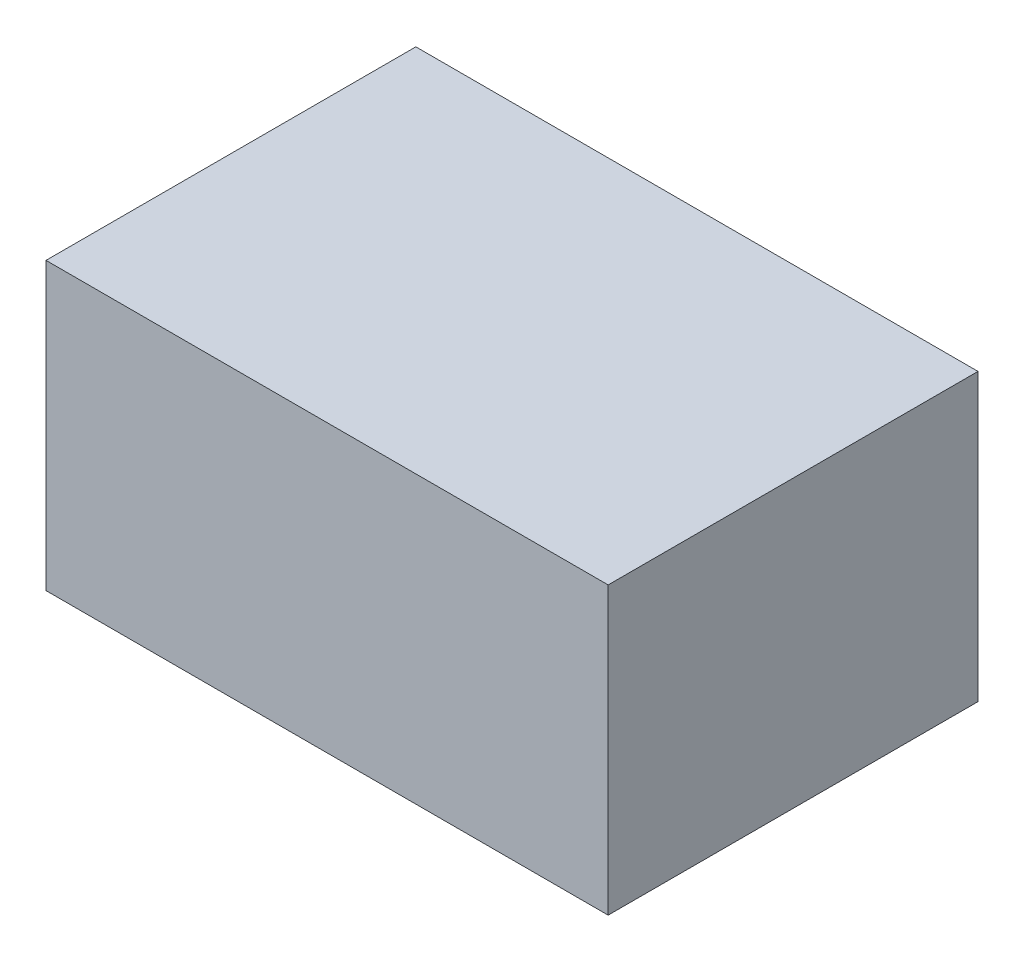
SolidWorks part; units mm, degrees
ref_plane "Front Plane" through (0, 0, 0) normal (0, 0, 1) x (1, 0, 0)
ref_plane "Top Plane" through (0, 0, 0) normal (0, 1, 0) x (1, 0, 0)
ref_plane "Right Plane" through (0, 0, 0) normal (1, 0, 0) x (0, 0, -1)
sketch "Sketch1" plane through (0, 0, 0) normal (0, 1, 0) x (1, 0, 0)
  line L1 (0, 0) -> (114, 0)
  line L2 (0, 0) -> (0, 75)
  line L3 (0, 75) -> (114, 75)
  line L4 (114, 0) -> (114, 75)
  dimension "D1" = 114
  dimension "D2" = 75
extrude "Boss-Extrude1" add sketch "Sketch1" along normal blind 58
